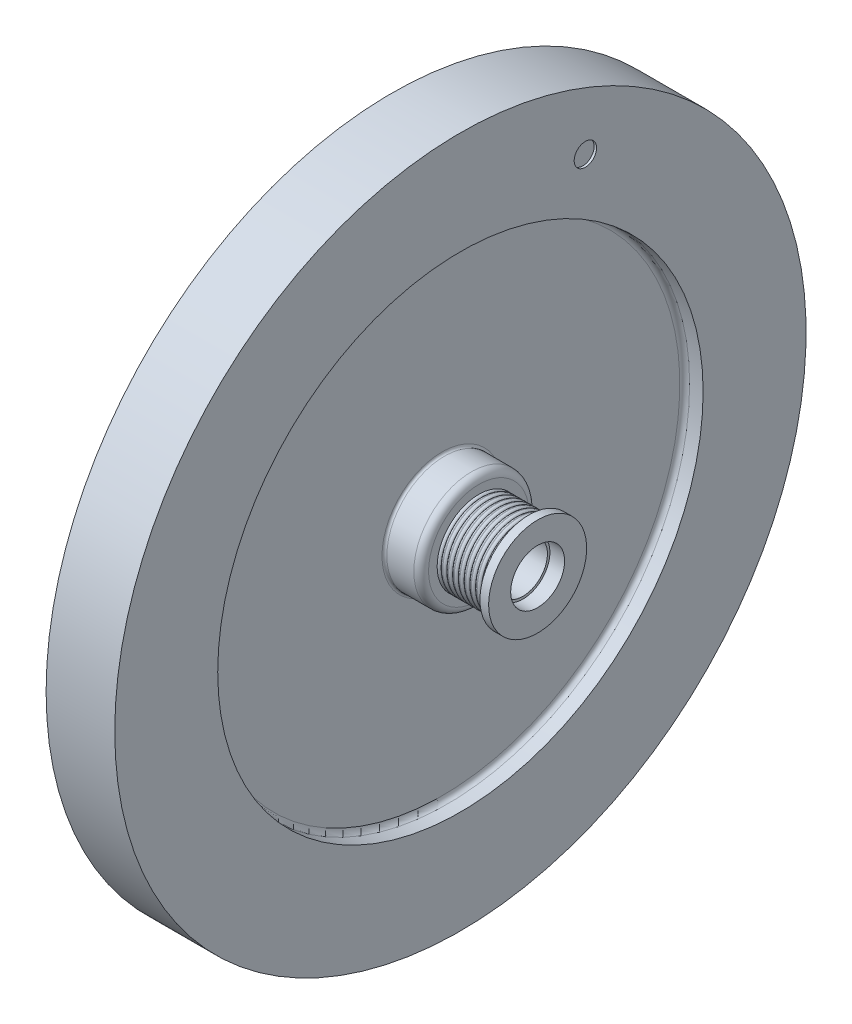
SolidWorks part; units mm, degrees
ref_plane "Plan de face" through (0, 0, 0) normal (0, 0, 1) x (1, 0, 0)
ref_plane "Plan de dessus" through (0, 0, 0) normal (0, 1, 0) x (1, 0, 0)
ref_plane "Plan de droite" through (0, 0, 0) normal (1, 0, 0) x (0, 0, -1)
imported_body "Importée1"
sketch "Esquisse1" plane through (491.3396, 0, 0) normal (1, 0, 0) x (0, 0, -1)
  circle A0 centre (50.9562, 345.2175) radius 4.5648
extrude "Enlèv. mat.-Extru.1" cut sketch "Esquisse1" against normal blind 1
